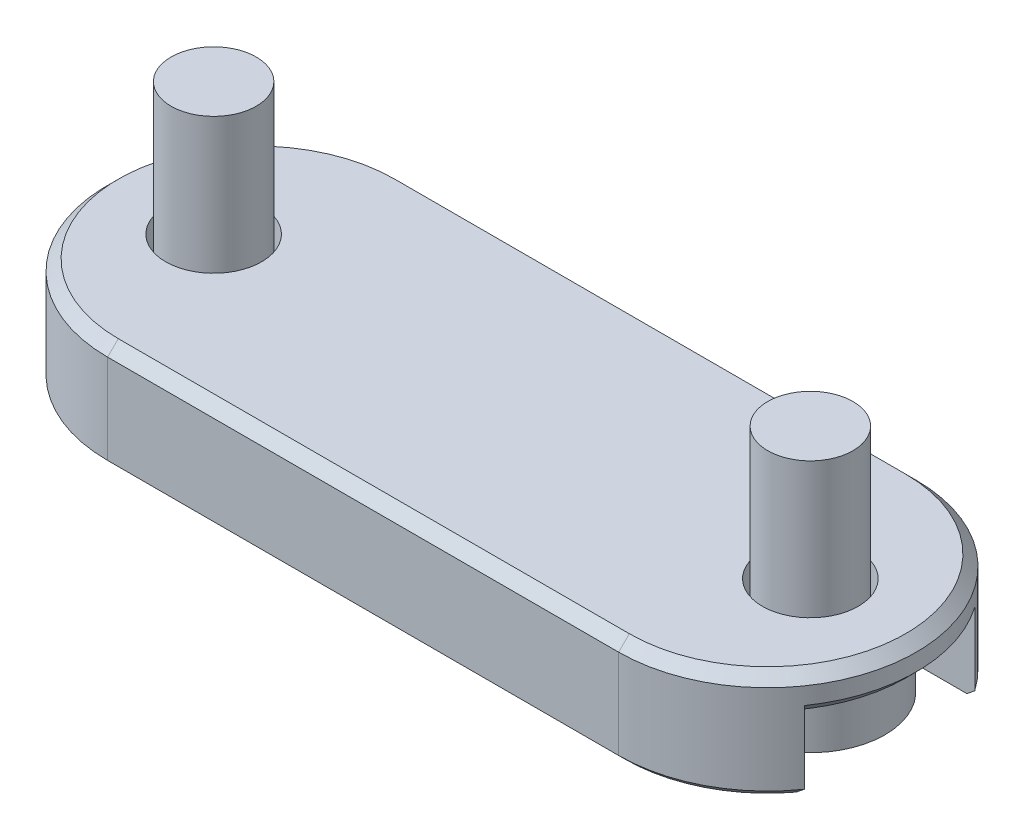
SolidWorks part; units mm, degrees
ref_plane "Front Plane" through (0, 0, 0) normal (0, 0, 1) x (1, 0, 0)
ref_plane "Top Plane" through (0, 0, 0) normal (0, 1, 0) x (1, 0, 0)
ref_plane "Right Plane" through (0, 0, 0) normal (1, 0, 0) x (0, 0, -1)
sketch "Sketch1" plane through (0, 0, 0) normal (0, 1, 0) x (1, 0, 0)
  line L0 (0, 6.99) -> (0, -6.99) construction
  line L1 (-11.99, 6.985) -> (11.99, 6.985)
  line L3 (-11.99, -6.985) -> (11.99, -6.985)
  line L5 (-9.5545, 0) -> (8.6705, 0) construction
  arc A0 (-11.99, 6.985) -> (-11.99, -6.985) centre (-11.99, 0) ccw
  arc A1 (11.99, -6.985) -> (11.99, 6.985) centre (11.99, 0) ccw
  circle A2 centre (-14, 0) radius 2.25
  circle A3 centre (14, 0) radius 2.25
  dimension "D3" = 28
  dimension "D1" = 37.95
  dimension "D4" = 4.5
  dimension "D2" = 13.97
extrude "Boss-Extrude1" add sketch "Sketch1" along normal blind 5
sketch "Sketch4" plane through (0, 0, 0) normal (-1, 0, 0) x (0, 0, -1)
  line L0 (-2.8957, 0) -> (-0.7071, -2.1886)
  line L1 (0.7071, -2.1886) -> (2.8957, 0)
  line L2 (0, -0.0283) -> (0, -5) construction
  line L3 (0, 0) -> (0, -5) construction
  line L4 (6.985, 0) -> (-6.985, 0) construction
  line L5 (-6.985, -5) -> (6.985, -5) construction
  line L6 (-2.8957, 0) -> (2.8957, 0)
  arc A4 (-0.7071, -2.1886) -> (0.7071, -2.1886) centre (0, -1.4815) ccw
  dimension "D1" = 1
  dimension "D3" = 2.4815
  dimension "D2" = 90
extrude "Cut-Extrude2" cut sketch "Sketch4" against normal through all both and the other way through all
sketch "Sketch3" plane through (0, 0, 0) normal (0, 1, 0) x (1, 0, 0)
  line L0 (-20, 4) -> (-14, 4)
  line L1 (-20, -4) -> (-14, -4)
  line L2 (-20, 4) -> (-20, -4)
  line L3 (14, 4) -> (20, 4)
  line L4 (20, 4) -> (20, -4)
  line L5 (20, -4) -> (14, -4)
  arc A0 (-14, -4) -> (-14, 4) centre (-14, 0) ccw
  arc A1 (14, 4) -> (14, -4) centre (14, 0) ccw
  dimension "D1" = 8
  dimension "D2" = 20
  dimension "D3" = 20
extrude "Cut-Extrude1" cut sketch "Sketch3" along normal blind 3.2
fillet "Fillet1" radius 0.5 2 edges at (0, 0, 2.8957) (0, 0, -2.8957)
chamfer "Chamfer1" distance 0.3 angle 45 6 edges at (15.2188, 0, -6.194) (-15.2188, 0, -6.194) (0, 0, -6.985) (-15.2188, 0, 6.194) (15.2188, 0, 6.194) (0, 0, 6.985)
chamfer "Chamfer2" distance 0.5 angle 45 6 edges at (-18.975, 3.2, 0) (18.975, 3.2, 0) (0, 5, -6.985) (-18.975, 5, 0) (18.975, 5, 0) (0, 5, 6.985)
sketch "Sketch6" plane through (0, 0, 0) normal (1, 0, 0) x (0, 0, -1)
  line L0 (-8, 0) -> (22.525, 0) construction
  line L1 (7.6835, 0) -> (-7.6835, 0) construction
  line L2 (-8, 0) -> (-8, -2)
  line L3 (-8, -2) -> (0, -2)
  line L4 (0, 6.16) -> (0, -6.16) construction
  line L5 (0, -2) -> (0, -3.5)
  line L6 (0, -3.5) -> (2.8, -3.5)
  line L7 (2.8, -3.5) -> (2.8, 0)
  line L8 (2.8, 0) -> (-8, 0)
  dimension "L" = 8
  dimension "H" = 2.8
  dimension "A" = 7
  dimension "D" = 4
revolve "Revolve1" add sketch "Sketch6" angle 360 about L0
sketch "Sketch7" plane through (0, 0, -2.8) normal (0, 0, -1) x (-1, 0, 0)
  line L2 (-1.25, 0.7217) -> (-1.25, -0.7217)
  line L4 (-1.25, -0.7217) -> (0, -1.4434)
  line L5 (0, -1.4434) -> (1.25, -0.7217)
  line L6 (1.25, -0.7217) -> (1.25, 0.7217)
  line L7 (1.25, 0.7217) -> (0, 1.4434)
  line L8 (0, 1.4434) -> (-1.25, 0.7217)
  circle A0 centre (0, 0) radius 1.25 construction
  dimension "J" = 2.5
extrude "HEX" cut sketch "Sketch7" against normal blind 2
move or copy body "Body-Move/Copy3" bodies to move or copy 107 copy no translate (13.3991, -10.6592, -5.7245) parameters "D1"=0, "D2"=0, "D3"=0
move or copy body "Body-Move/Copy2" bodies to move or copy 108 placed by mates yes parameters "D1"=0, "D2"=0, "D3"=0
mirror "Mirror1" about plane through (0, 0, 0) normal (1, 0, 0)
